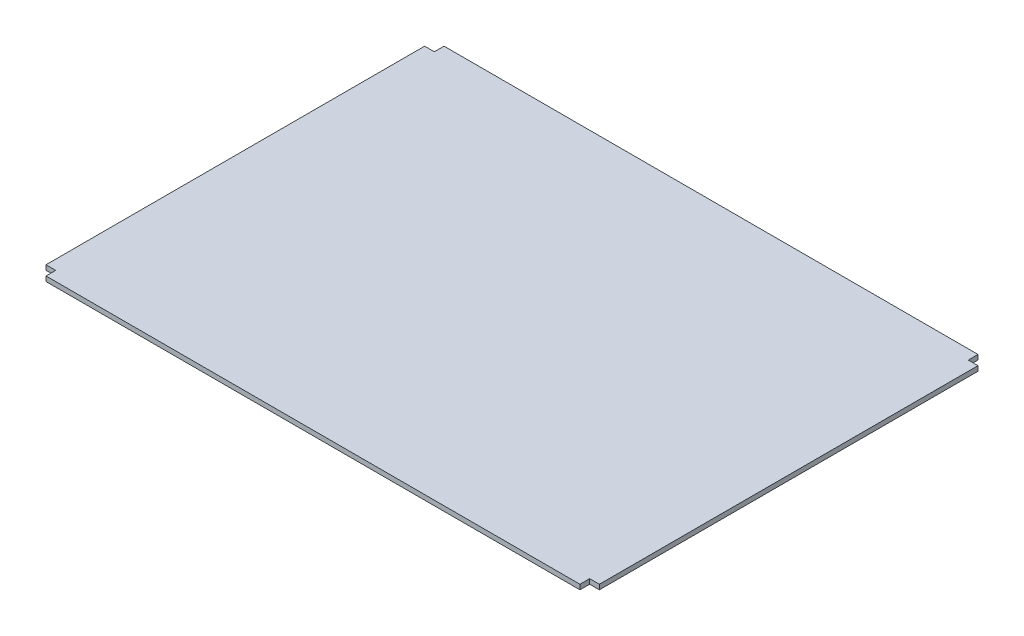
SolidWorks part; units mm, degrees
ref_plane "Front Plane" through (0, 0, 0) normal (0, 0, 1) x (1, 0, 0)
ref_plane "Top Plane" through (0, 0, 0) normal (0, 1, 0) x (1, 0, 0)
ref_plane "Right Plane" through (0, 0, 0) normal (1, 0, 0) x (0, 0, -1)
sketch "Sketch1" plane through (0, 0, 0) normal (0, 1, 0) x (1, 0, 0)
  line L1 (-361.95, -260.35) -> (361.95, -260.35)
  line L2 (-361.95, -260.35) -> (-361.95, 260.35)
  line L3 (-361.95, 260.35) -> (361.95, 260.35)
  line L4 (361.95, -260.35) -> (361.95, 260.35)
  line L5 (-361.95, -260.35) -> (361.95, 260.35) construction
  line L6 (-361.95, 260.35) -> (361.95, -260.35) construction
  point P0 (0, 0)
  dimension "D1" = 723.9
  dimension "D2" = 520.7
extrude "Boss-Extrude1" add sketch "Sketch1" along normal blind 6.35
sketch "Sketch2" plane through (0, 6.35, 0) normal (0, 1, 0) x (1, 0, 0)
  line L1 (-361.95, -260.35) -> (-349.25, -260.35)
  line L2 (-361.95, -260.35) -> (-361.95, -247.65)
  line L3 (-361.95, -247.65) -> (-349.25, -247.65)
  line L4 (-349.25, -260.35) -> (-349.25, -247.65)
  line L5 (-361.95, 260.35) -> (-349.25, 260.35)
  line L6 (-361.95, 260.35) -> (-361.95, 247.65)
  line L7 (-361.95, 247.65) -> (-349.25, 247.65)
  line L8 (-349.25, 260.35) -> (-349.25, 247.65)
  line L9 (361.95, 260.35) -> (349.25, 260.35)
  line L10 (361.95, 260.35) -> (361.95, 247.65)
  line L11 (361.95, 247.65) -> (349.25, 247.65)
  line L12 (349.25, 260.35) -> (349.25, 247.65)
  line L13 (361.95, -260.35) -> (349.25, -260.35)
  line L14 (361.95, -260.35) -> (361.95, -247.65)
  line L15 (361.95, -247.65) -> (349.25, -247.65)
  line L16 (349.25, -260.35) -> (349.25, -247.65)
  dimension "D1" = 12.7
  dimension "D2" = 12.7
  dimension "D3" = 12.7
  dimension "D4" = 12.7
  dimension "D5" = 12.7
  dimension "D6" = 12.7
  dimension "D7" = 12.7
  dimension "D8" = 12.7
extrude "Cut-Extrude1" cut sketch "Sketch2" against normal blind 6.35
